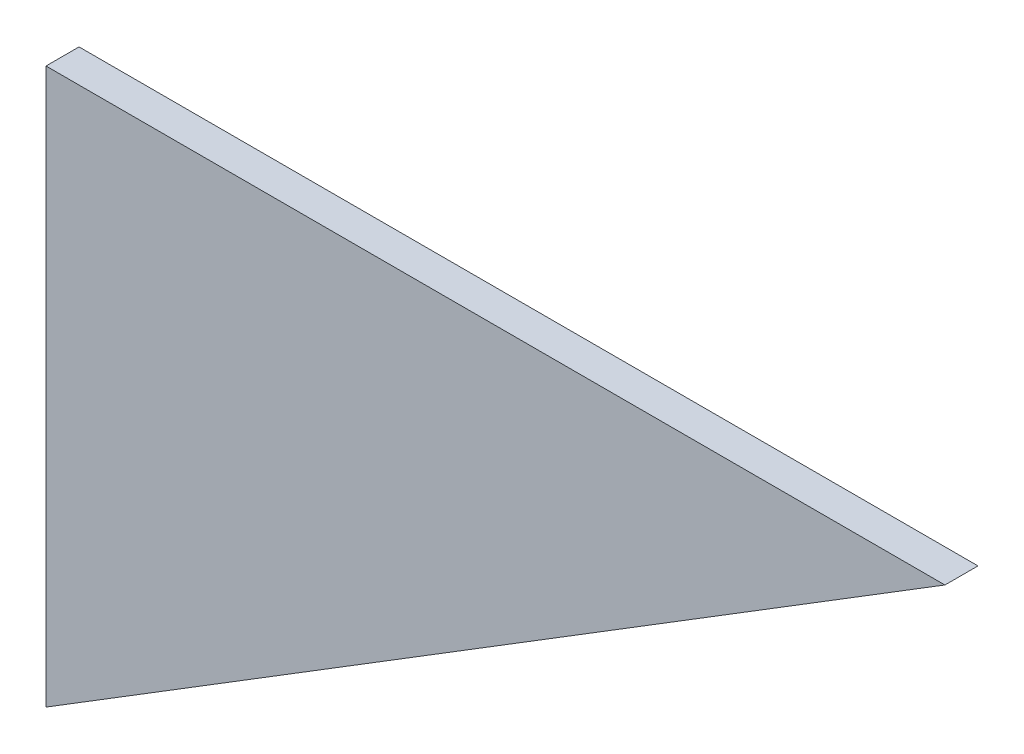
SolidWorks part; units mm, degrees
ref_plane "Plan de face" through (0, 0, 0) normal (0, 0, 1) x (1, 0, 0)
ref_plane "Plan de dessus" through (0, 0, 0) normal (0, 1, 0) x (1, 0, 0)
ref_plane "Plan de droite" through (0, 0, 0) normal (1, 0, 0) x (0, 0, -1)
sketch "Esquisse1" plane through (0, 0, 0) normal (0, 0, 1) x (1, 0, 0)
  line L0 (-42.5174, 28.3955) -> (-42.5174, -55.6045)
  line L1 (-42.5174, -55.6045) -> (93.4826, 28.3955)
  line L2 (93.4826, 28.3955) -> (-42.5174, 28.3955)
  dimension "D1" = 136
  dimension "D2" = 84
extrude "Extrusion1" add sketch "Esquisse1" along normal blind 5
